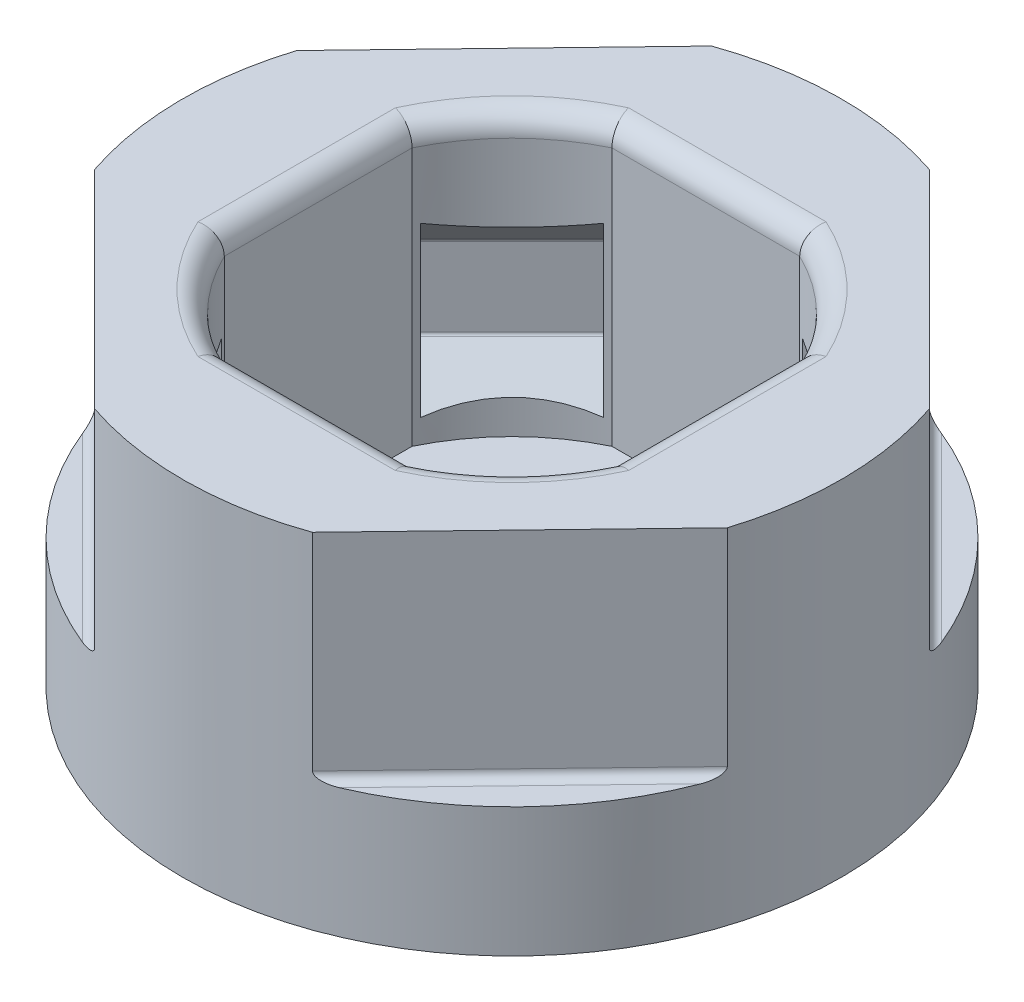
SolidWorks part; units mm, degrees
ref_plane "Front Plane" through (0, 0, 0) normal (0, 0, 1) x (1, 0, 0)
ref_plane "Top Plane" through (0, 0, 0) normal (0, 1, 0) x (1, 0, 0)
ref_plane "Right Plane" through (0, 0, 0) normal (1, 0, 0) x (0, 0, -1)
sketch "Sketch1" plane through (0, 0, 0) normal (0, 1, 0) x (1, 0, 0)
  circle A0 centre (0, 0) radius 7.65
extrude "Boss-Extrude1" add sketch "Sketch1" along normal blind 8 contours A0
sketch "Sketch2" plane through (0, 8, 0) normal (0, 1, 0) x (1, 0, 0)
  line L1 (-4.5, -4.5) -> (4.5, -4.5)
  line L2 (-4.5, -4.5) -> (-4.5, 4.5)
  line L3 (-4.5, 4.5) -> (4.5, 4.5)
  line L4 (4.5, -4.5) -> (4.5, 4.5)
  circle A0 centre (0, 0) radius 5
  point P0 (0, 0)
  dimension "D1" = 9
extrude "Cut-Extrude1" cut sketch "Sketch2" against normal blind 6.5 contours L1 A0 L4 L3 L2
sketch "Sketch3" plane through (0, 0, -4.5) normal (0, 0, 1) x (1, 0, 0)
  line L0 (-7.65, 0) -> (7.65, 0) construction
  line L6 (-1.4994, 6) -> (1.5006, 6)
  line L8 (-1.4994, 6) -> (-1.4994, 2)
  line L9 (-1.4994, 2) -> (1.5006, 2)
  line L10 (1.5006, 6) -> (1.5006, 2)
  line L11 (-1.4994, 6) -> (1.5006, 2) construction
  line L12 (-1.4994, 2) -> (1.5006, 6) construction
  line L13 (-2.1794, 1.5) -> (-2.1794, 8) construction
  point P2 (0.0006, 4)
  dimension "D1" = 2
  dimension "D2" = 4
  dimension "D3" = 3
  dimension "D4" = 0.68
sketch "Sketch4" plane through (0, 0, 0) normal (1, 0, 0) x (0, 0, -1)
  line L0 (0, 0) -> (0, 8)
  line L1 (-2.1794, 8) -> (2.1794, 8) construction
fillet "Fillet4" radius 0.5 8 edges at (-3.5355, 8, 3.5355) (0, 8, 4.5) (3.5355, 8, 3.5355) (4.5, 8, 0) (3.5355, 8, -3.5355) (0, 8, -4.5) (-3.5355, 8, -3.5355) (-4.5, 8, 0)
sketch "Sketch7" plane through (0, 8, 0) normal (0, 1, 0) x (1, 0, 0)
  line L0 (-7.252, -2.4354) -> (2.4354, 7.252)
  line L1 (-7.65, -7.65) -> (7.65, -7.65) construction
  line L2 (-7.65, -7.65) -> (-7.65, 7.65) construction
  line L3 (-7.65, 7.65) -> (7.65, 7.65) construction
  line L4 (7.65, -7.65) -> (7.65, 7.65) construction
  line L5 (-7.65, -7.65) -> (7.65, 7.65) construction
  line L6 (-7.65, 7.65) -> (7.65, -7.65) construction
  line L7 (-7.252, -2.4354) -> (-2.4354, -7.252)
  line L8 (2.4354, 7.252) -> (7.252, 2.4354)
  line L9 (-2.4354, -7.252) -> (7.252, 2.4354)
  line L10 (-7.252, -2.4354) -> (7.252, 2.4354) construction
  line L11 (2.4354, 7.252) -> (-2.4354, -7.252) construction
  line L12 (2.572, -7.2047) -> (-7.2967, 2.2979)
  line L13 (2.572, -7.2047) -> (7.2967, -2.2979)
  line L14 (-7.2967, 2.2979) -> (-2.572, 7.2047)
  line L15 (7.2967, -2.2979) -> (-2.572, 7.2047)
  line L16 (2.572, -7.2047) -> (-2.572, 7.2047) construction
  line L17 (-7.2967, 2.2979) -> (7.2967, -2.2979) construction
  circle A0 centre (0, 0) radius 7.65
  dimension "D1" = 15.3
  dimension "D2" = 15.3
  dimension "D3" = 15.3
  dimension "D4" = 13.7
  dimension "D5" = 13.7
extrude "Cut-Extrude2" cut sketch "Sketch7" against normal blind 5 contours L8 M13 | L7 M13 | L14 M13 | L13 M13
fillet "Fillet5" radius 0.2 4 edges at (-4.9343, 3, -4.7513) (4.8437, 3, -4.8437) (4.9343, 3, 4.7513) (-4.8437, 3, 4.8437)
ref_plane "Plane1" through (-3.3397, 0, -3.3397) normal (-0.7071, 0, -0.7071) x (-0.7071, 0, 0.7071)
sketch "Sketch8" plane through (-3.3397, 0, -3.3397) normal (-0.7071, 0, -0.7071) x (-0.7071, 0, 0.7071)
  line L0 (0, 0) -> (0, 8) construction
  line L1 (-1.5, 6) -> (1.5, 6)
  line L2 (-1.5, 6) -> (-1.5, 2)
  line L3 (-1.5, 2) -> (1.5, 2)
  line L4 (1.5, 6) -> (1.5, 2)
  line L5 (-1.5, 6) -> (1.5, 2) construction
  line L6 (-1.5, 2) -> (1.5, 6) construction
  line L7 (1.6409, 1.5) -> (-1.6409, 1.5) construction
  point P0 (0, 4)
  dimension "D1" = 3
  dimension "D2" = 4
  dimension "D3" = 0.5
ref_plane "Plane2" through (-4.0468, 0, -4.0468) normal (-0.7071, 0, -0.7071) x (-0.7071, 0, 0.7071)
sketch "Sketch9" plane through (-4.0468, 0, -4.0468) normal (-0.7071, 0, -0.7071) x (-0.7071, 0, 0.7071)
  line L0 (1.5, 6) -> (1.5, 2) construction
  line L1 (-1.5, 4.95) -> (1.5, 4.95)
  line L2 (-1.5, 4.95) -> (-1.5, 3.05)
  line L3 (-1.5, 3.05) -> (1.5, 3.05)
  line L4 (1.5, 4.95) -> (1.5, 3.05)
  line L5 (-1.5, 4.95) -> (1.5, 3.05) construction
  line L6 (-1.5, 3.05) -> (1.5, 4.95) construction
  point P0 (0, 4)
  dimension "D1" = 1.9
loft "Cut-Loft2" cut profiles "Sketch8", "Sketch9"
fillet "Fillet6" radius 0.1 2 edges
pattern_circular "CirPattern1" count 4 every 90 about axis through (0, 0, 0) along (0, 1, 0) of "Cut-Loft2", "Fillet6"
